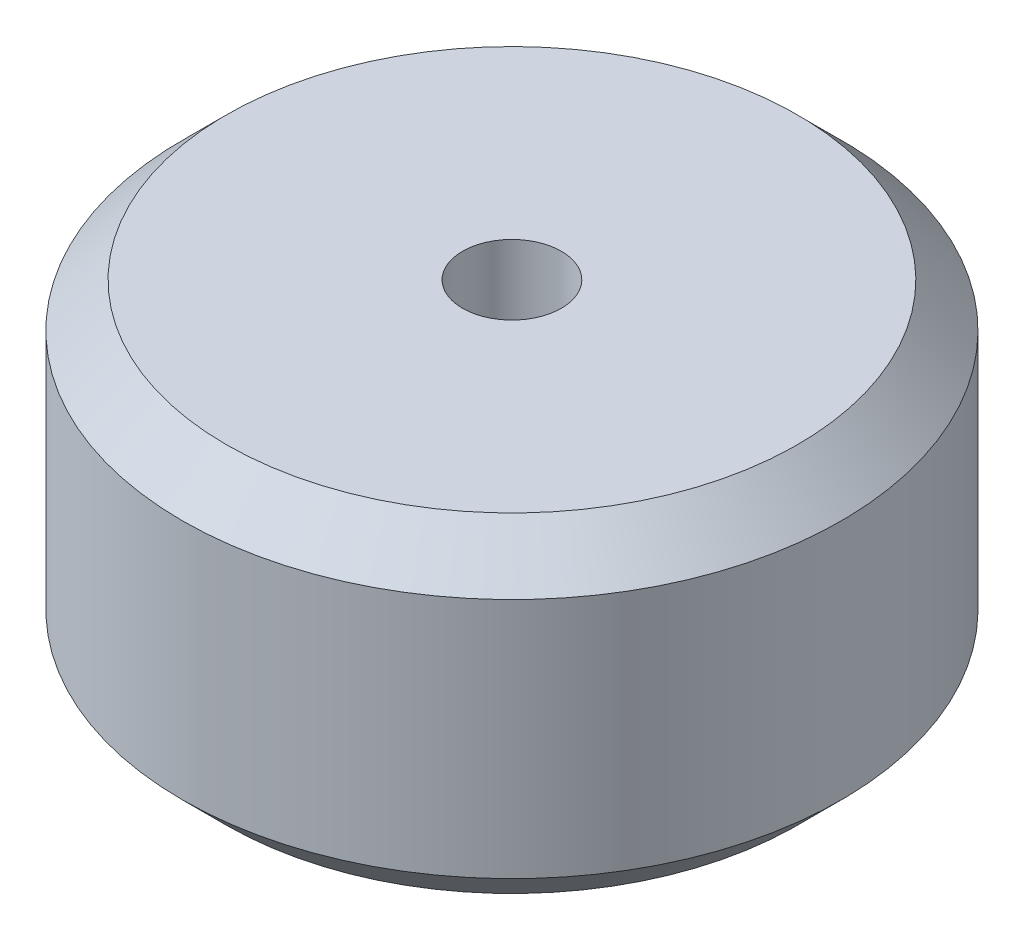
SolidWorks part; units mm, degrees
ref_plane "Front Plane" through (0, 0, 0) normal (0, 0, 1) x (1, 0, 0)
ref_plane "Top Plane" through (0, 0, 0) normal (0, 1, 0) x (1, 0, 0)
ref_plane "Right Plane" through (0, 0, 0) normal (1, 0, 0) x (0, 0, -1)
sketch "Sketch1" plane through (0, 0, 0) normal (0, 1, 0) x (1, 0, 0)
  circle A0 centre (0, 0) radius 15
  dimension "D1" = 30
extrude "Extrude1" add sketch "Sketch1" along normal blind 15
chamfer "Chamfer1" distance 2 angle 45 2 edges at (0, 0, 15) (0, 15, 15)
sketch "Sketch2" plane through (0, 15, 0) normal (0, 1, 0) x (1, 0, 0)
  circle A0 centre (0, 0) radius 2.25
  dimension "D1" = 4.5
extrude "Extrude2" cut sketch "Sketch2" against normal blind 7.5
